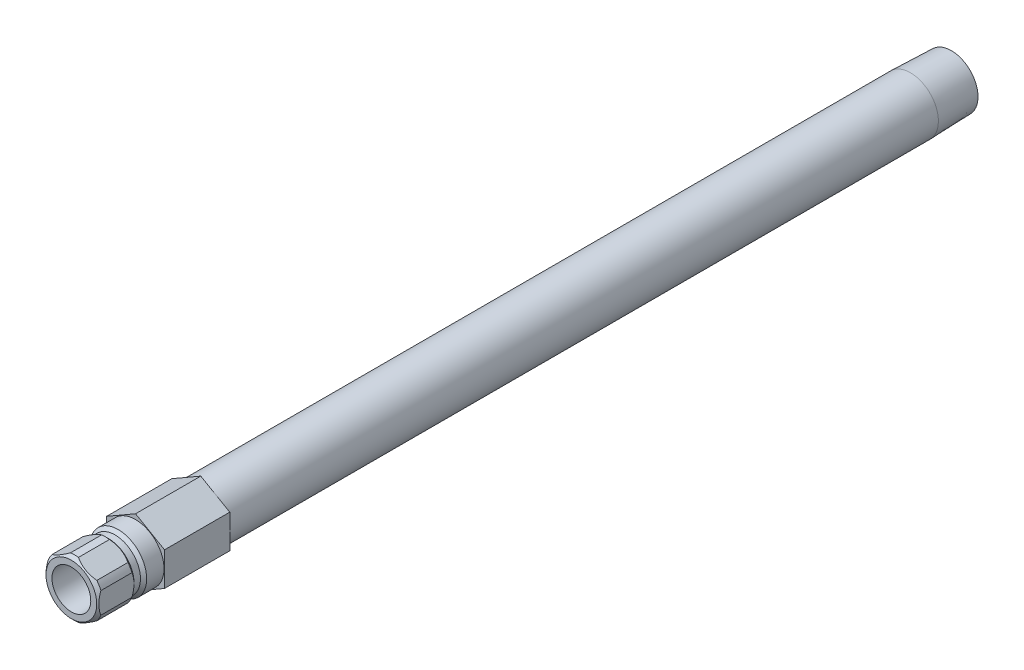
SolidWorks part; units mm, degrees
ref_plane "Front Plane" through (0, 0, 0) normal (0, 0, 1) x (1, 0, 0)
ref_plane "Top Plane" through (0, 0, 0) normal (0, 1, 0) x (1, 0, 0)
ref_plane "Right Plane" through (0, 0, 0) normal (1, 0, 0) x (0, 0, -1)
sketch "Sketch1" plane through (0, 0, 0) normal (1, 0, 0) x (0, 0, -1)
  line L0 (-12.8748, 0) -> (-18.923, 0) construction
  line L1 (-15.748, 4.7625) -> (-15.748, 6.223)
  line L2 (-6.604, 6.223) -> (-6.604, 0) construction
  line L3 (-14.986, 6.985) -> (-7.366, 6.985)
  line L4 (-3.556, 4.7625) -> (-3.556, 6.858) construction
  line L5 (-6.604, 6.223) -> (-5.0165, 6.223)
  line L6 (-4.2545, 6.985) -> (0, 6.985)
  line L7 (0, 6.985) -> (0, 6.858)
  line L8 (-6.604, 6.223) -> (-7.366, 6.985)
  line L9 (-5.0165, 6.223) -> (-4.2545, 6.985)
  line L10 (-15.748, 6.223) -> (-14.986, 6.985)
  line L11 (-15.748, 4.7625) -> (-3.556, 4.7625)
  line L12 (0, 6.858) -> (190.119, 6.858)
  line L13 (190.119, 6.858) -> (200.152, 6.5445)
  line L14 (200.152, 6.5445) -> (200.152, 4.6228)
  line L15 (-3.556, 4.7625) -> (-3.4817, 4.6228)
  line L16 (16.002, 6.858) -> (16.002, 0) construction
  line L17 (16.002, 0) -> (-12.8748, 0) construction
  line L19 (-3.4817, 4.6228) -> (200.152, 4.6228)
  dimension "D1" = 15.748
  dimension "D2" = 1.5875
  dimension "D3" = 0.762
  dimension "D4" = 45
  dimension "D5" = 9.144
  dimension "D6" = 45
  dimension "D7" = 1.79
  dimension "D8" = 10.033
  dimension "D9" = 215.9
  dimension "D10" = 3.175
  dimension "D11" = 9.525
  dimension "D12" = 13.716
  dimension "D13" = 31.75
  dimension "D14" = 13.97
  dimension "D15" = 9.2456
  dimension "D17" = 118
  dimension "D18" = 12.192
revolve "Revolve1" add sketch "Sketch1" angle 360 about L0
sketch "Sketch2" plane through (0, 0, 0) normal (0, 0, 1) x (1, 0, 0)
  line L1 (-7.112, 4.1061) -> (-7.112, -4.1061)
  line L2 (-7.112, -4.1061) -> (0, -8.2122)
  line L3 (0, -8.2122) -> (7.112, -4.1061)
  line L4 (7.112, -4.1061) -> (7.112, 4.1061)
  line L5 (7.112, 4.1061) -> (0, 8.2122)
  line L6 (0, 8.2122) -> (-7.112, 4.1061)
  circle A0 centre (0, 0) radius 7.112 construction
  circle A1 centre (0, 0) radius 4.6228 construction
  circle A2 centre (0, 0) radius 4.6228
  dimension "D1" = 14.224
extrude "Boss-Extrude1" add sketch "Sketch2" against normal up to vertex (16.002 mm away)
sketch "Sketch3" plane through (0, 0, 0) normal (0, 0, 1) x (1, 0, 0)
  line L1 (6.477, -3.7395) -> (6.477, 3.7395)
  line L2 (6.477, 3.7395) -> (0, 7.479)
  line L3 (0, 7.479) -> (-6.477, 3.7395)
  line L4 (-6.477, 3.7395) -> (-6.477, -3.7395)
  line L5 (-6.477, -3.7395) -> (0, -7.479)
  line L6 (0, -7.479) -> (6.477, -3.7395)
  circle A0 centre (0, 0) radius 6.477 construction
  dimension "D1" = 12.954
extrude "Cut-Extrude1" cut sketch "Sketch3" along normal through all from vertex at 6.604 flip side to cut
